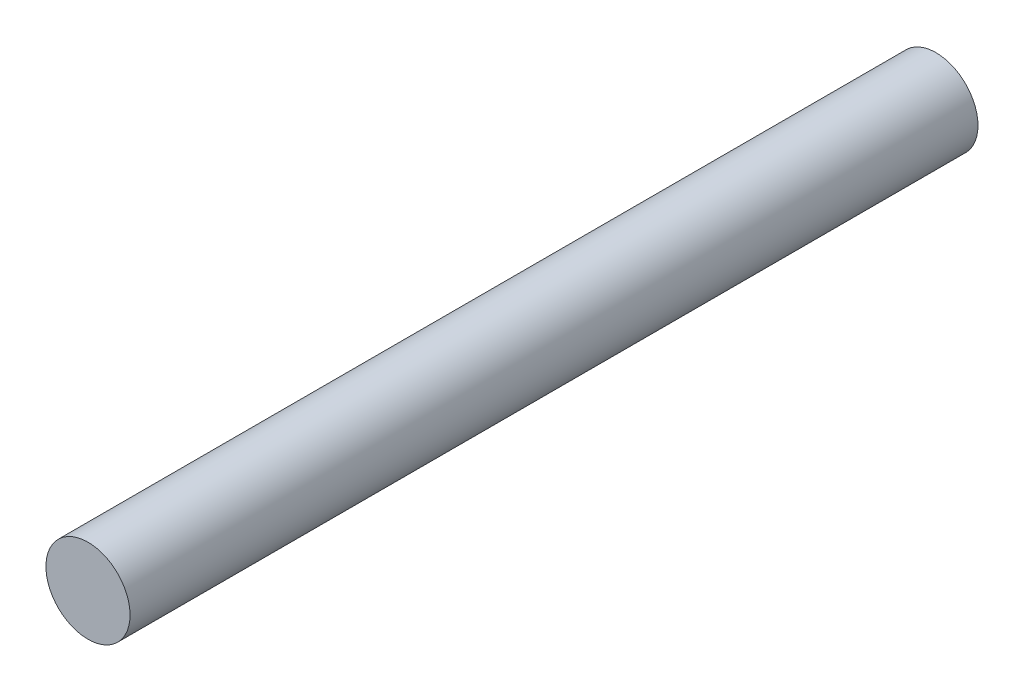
SolidWorks part; units mm, degrees
ref_plane "Front Plane" through (0, 0, 0) normal (0, 0, 1) x (1, 0, 0)
ref_plane "Top Plane" through (0, 0, 0) normal (0, 1, 0) x (1, 0, 0)
ref_plane "Right Plane" through (0, 0, 0) normal (1, 0, 0) x (0, 0, -1)
sketch "Sketch2" plane through (0, 0, 0) normal (0, 0, 1) x (1, 0, 0)
  circle A0 centre (0, 0) radius 25
  dimension "D1" = 50
extrude "Boss-Extrude1" add sketch "Sketch2" along normal blind 504
